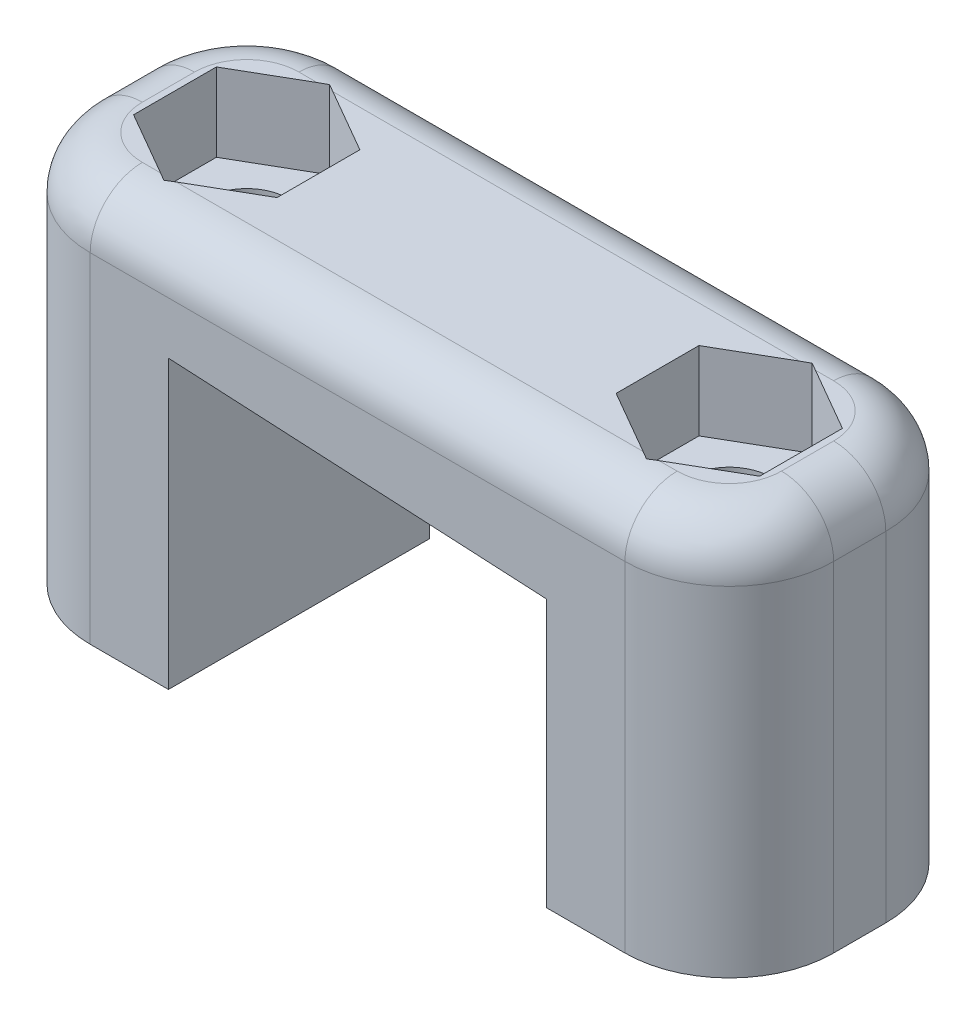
SolidWorks part; units mm, degrees
ref_plane "Спереди" through (0, 0, 0) normal (0, 0, 1) x (1, 0, 0)
ref_plane "Сверху" through (0, 0, 0) normal (0, 1, 0) x (1, 0, 0)
ref_plane "Справа" through (0, 0, 0) normal (1, 0, 0) x (0, 0, -1)
sketch "Эскиз1" plane through (0, 0, 0) normal (0, 0, 1) x (1, 0, 0)
  line L0 (0, -15) -> (7, -15)
  line L1 (7, -15) -> (7, -4)
  line L2 (7, -4) -> (21.5, -4.75)
  line L3 (21.5, -4.75) -> (21.5, -15)
  line L4 (21.5, -15) -> (28.5, -15)
  line L5 (28.5, -15) -> (28.5, 0)
  line L6 (28.5, 0) -> (0, 0)
  line L7 (0, 0) -> (0, -15)
  dimension "D1" = 7
  dimension "D2" = 14.5
  dimension "D3" = 7
  dimension "D4" = 11
  dimension "D5" = 10.25
  dimension "D6" = 15
extrude "Бобышка-Вытянуть1" add sketch "Эскиз1" along normal blind 10
fillet "Скругление1" radius 2 4 edges at (0, 0, 5) (28.5, 0, 5) (14.25, 0, 0) (14.25, 0, 10)
fillet "Скругление2" radius 4 8 edges at (27.9142, -0.5858, 9.4142) (27.9142, -0.5858, 0.5858) (0.5858, -0.5858, 9.4142) (0.5858, -0.5858, 0.5858) (0, -8.5, 0) (0, -8.5, 10) (28.5, -8.5, 0) (28.5, -8.5, 10)
sketch "Эскиз2" plane through (0, -15, 0) normal (0, -1, 0) x (1, 0, 0)
  line L0 (28.5, 6) -> (28.5, 4) construction
  line L1 (21.5, 0) -> (24.5, 0) construction
  line L2 (23.5, 5) -> (0, 5) construction
  line L5 (5, 14.2415) -> (5, -3.2799) construction
  line L6 (0, 6) -> (0, 4) construction
  circle A0 centre (23.5, 5) radius 1.6
  circle A1 centre (5, 5) radius 1.6
  dimension "D1" = 3.2
  dimension "D2" = 5
  dimension "D3" = 5
  dimension "D4" = 5
extrude "Вырез-Вытянуть1" cut sketch "Эскиз2" against normal through all
sketch "Эскиз5" plane through (0, -15, 0) normal (0, -1, 0) x (1, 0, 0)
  line L0 (0, 6) -> (0, 4) construction
  line L1 (0, 5) -> (28.5, 5) construction
  line L2 (28.5, 6) -> (28.5, 4) construction
sketch "Эскиз6" plane through (0, -15, 0) normal (0, -1, 0) x (1, 0, 0)
  line L0 (23.5, 5) -> (23.5, 8.2769) construction
  line L1 (5, 5) -> (5, 8.2769) construction
sketch "Эскиз7" plane through (0, 0, 0) normal (0, 1, 0) x (1, 0, 0)
  line L0 (24.5, -2) -> (4, -2) construction
  line L1 (26.25, -3.4123) -> (23.5, -1.8246)
  line L2 (23.5, -1.8246) -> (20.75, -3.4123)
  line L3 (20.75, -3.4123) -> (20.75, -6.5877)
  line L4 (20.75, -6.5877) -> (23.5, -8.1754)
  line L5 (23.5, -8.1754) -> (26.25, -6.5877)
  line L6 (26.25, -6.5877) -> (26.25, -3.4123)
  line L8 (7.75, -3.4123) -> (5, -1.8246)
  line L9 (5, -1.8246) -> (2.25, -3.4123)
  line L10 (2.25, -3.4123) -> (2.25, -6.5877)
  line L11 (2.25, -6.5877) -> (5, -8.1754)
  line L12 (5, -8.1754) -> (7.75, -6.5877)
  line L13 (7.75, -6.5877) -> (7.75, -3.4123)
  circle A0 centre (23.5, -5) radius 3.1754 construction
  circle A1 centre (5, -5) radius 2.75 construction
  dimension "D1" = 5.5
extrude "Вырез-Вытянуть5" cut sketch "Эскиз7" against normal blind 3 contours L2 L3 L4 L5 L6 L1 | L9 L10 L11 L12 L13 L8
